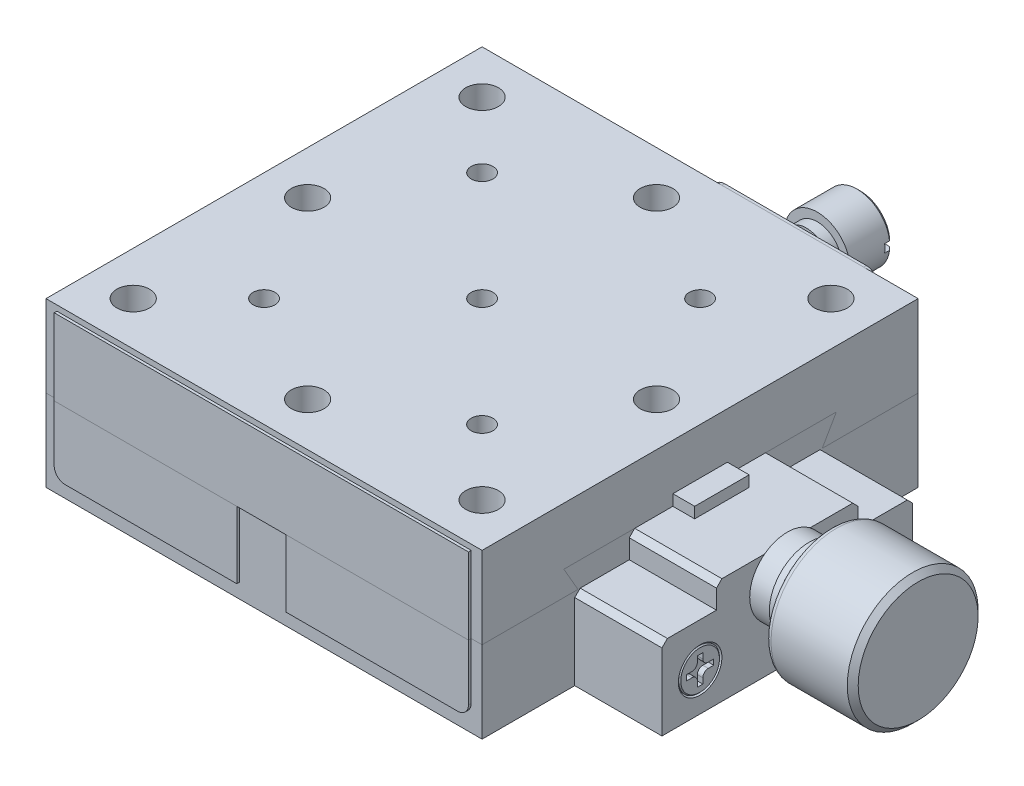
SolidWorks part; units mm, degrees
ref_plane "Front Plane" through (0, 0, 0) normal (0, 0, 1) x (1, 0, 0)
ref_plane "Top Plane" through (0, 0, 0) normal (0, 1, 0) x (1, 0, 0)
ref_plane "Right Plane" through (0, 0, 0) normal (1, 0, 0) x (0, 0, -1)
sketch "Sketch1" plane through (0, 0, 0) normal (0, 0, 1) x (1, 0, 0)
  line L0 (-17.5553, 0) -> (22.6305, 0) construction
  line L1 (-20, 7.5) -> (20, 7.5)
  line L2 (-20, 7.5) -> (-20, -7.5)
  line L3 (-20, -7.5) -> (20, -7.5)
  line L4 (20, 7.5) -> (20, -7.5)
  line L5 (0, 11.3249) -> (0, -12.2184) construction
  dimension "D1" = 40
  dimension "D2" = 15
extrude "Extrude1" add sketch "Sketch1" against normal mid plane 40
sketch "Sketch3" plane through (-20, 0, 0) normal (-1, 0, 0) x (0, 0, 1)
  line L0 (-20, 0) -> (-11.201, 0)
  line L2 (-11.201, 0) -> (-12.5, 2.25)
  line L3 (-12.5, 2.25) -> (12.5, 2.25)
  line L4 (12.5, 2.25) -> (11.201, 0)
  line L5 (11.201, 0) -> (20, 0)
  line L7 (0, 9.2862) -> (0, -8.8555) construction
  line L9 (-20, -7.5) -> (20, -7.5) construction
  line L10 (-20, 7.5) -> (-20, -7.5) construction
  line L11 (20, 7.5) -> (20, -7.5) construction
  dimension "D1" = 25
  dimension "D2" = 2.25
  dimension "D3" = 60
  dimension "D4" = 7.5
split "Split1" trim tools "Sketch3" resulting bodies 102 103
sketch "Sketch4" plane through (20, 0, 0) normal (1, 0, 0) x (0, 0, -1)
  line L0 (-11.5, -7.5) -> (-11.5, 0)
  line L1 (-20, 0) -> (-11.201, 0) construction
  line L2 (-11.5, 0) -> (-6.5, 0)
  line L3 (-6.5, 0) -> (-6.5, 2.25)
  line L4 (-6.5, 2.25) -> (6.5, 2.25)
  line L5 (6.5, 2.25) -> (6.5, 0)
  line L6 (6.5, 0) -> (11.5, 0)
  line L7 (11.201, 0) -> (20, 0) construction
  line L8 (11.5, 0) -> (11.5, -7.5)
  line L9 (11.5, -7.5) -> (-11.5, -7.5)
  line L10 (0, 10.5069) -> (0, -9.7219) construction
  line L12 (-12.5, 2.25) -> (12.5, 2.25) construction
  line L13 (20, -7.5) -> (-20, -7.5) construction
  dimension "D1" = 13
  dimension "D2" = 23
extrude "Extrude2" add sketch "Sketch4" along normal blind 8 separate body
sketch "Sketch5" plane through (0, 0, 0) normal (0, 0, 1) x (1, 0, 0)
  line L0 (-16.9557, -0.5) -> (34.9975, -0.5) construction
  line L1 (28, -0.5) -> (28, 2.95)
  line L2 (28, 2.95) -> (30, 2.95)
  line L3 (30, 2.95) -> (30, 3.15)
  line L4 (32, 3.15) -> (32, 5)
  line L5 (32.5, 5.5) -> (39.5, 5.5)
  line L6 (40, 5) -> (40, -0.5)
  line L7 (28, 0) -> (28, -7.5) construction
  line L8 (20, -7.5) -> (20, 0) construction
  line L10 (-20, -7.5) -> (20, -7.5) construction
  line L11 (39.5, 5.5) -> (40, 5)
  line L12 (28, 2.25) -> (20, 2.25) construction
  line L13 (30, 3.15) -> (32, 3.15)
  line L14 (28, -0.5) -> (40, -0.5)
  arc A0 (32, 5) -> (32.5, 5.5) centre (32.5, 5) cw
  point P17 (40, 5.5)
  dimension "D4" = 0.5
  dimension "D1" = 20
  dimension "D2" = 12
  dimension "D3" = 7
  dimension "D6" = 0.5
  dimension "D5" = 2
  dimension "D7" = 0.7
  dimension "D8" = 0.2
revolve "Revolve1" add sketch "Sketch5" angle 360 about L0
ref_plane "Plane1" through (0, 0, 16) normal (0, 0, 1) x (1, 0, 0)
sketch "Sketch7" plane through (0, 0, 16) normal (0, 0, 1) x (1, 0, 0)
  line L0 (0, 10.5598) -> (0, -0.7863) construction
  line L1 (20, 7.5) -> (-20, 7.5) construction
  line L2 (0, 7.5) -> (1.5, 7.5)
  line L3 (0, 7.5) -> (0, 0.5987)
  line L4 (-0.3822, 1.5) -> (1.4322, 1.5) construction
  line L5 (1.5, 7.5) -> (1.5, 1.5)
  line L6 (1.5, 1.5) -> (0, 0.5987)
  dimension "D1" = 59
  dimension "D2" = 6
  dimension "D3" = 3
revolve "Cut-Revolve1" cut sketch "Sketch7" angle 360 about L0
pattern_linear "LPattern1" count 2 spacing 16 along (1, 0, 0) count 2 spacing 16 along (-1, 0, 0) of "Cut-Revolve1"
pattern_linear "LPattern2" count 2 spacing 32 along (0, 0, -1) of "LPattern1", "Cut-Revolve1"
sketch "Sketch8" plane through (0, 0, 0) normal (0, 0, 1) x (1, 0, 0)
  line L0 (-16, 8.7759) -> (-16, -1.8346) construction
  line L1 (20, 7.5) -> (-20, 7.5) construction
  line L2 (-16, 7.5) -> (-14.5, 7.5)
  line L3 (-16, 7.5) -> (-16, 1.3487)
  line L4 (-16, 1.3487) -> (-14.5, 2.25)
  line L5 (-14.5, 7.5) -> (-14.5, 2.25)
  line L6 (20, 2.25) -> (-20, 2.25) construction
  dimension "D2" = 3
  dimension "D3" = 16
  dimension "D4" = 59
revolve "Cut-Revolve2" cut sketch "Sketch8" angle 360 about L0
pattern_linear "LPattern3" count 2 spacing 32 along (1, 0, 0) of "Cut-Revolve2"
sketch "Sketch9" plane through (0, 2.25, 0) normal (0, 1, 0) x (-1, 0, 0)
  line L0 (-20, -20) -> (-20, 20) construction
  line L1 (-22, -2.5) -> (-20, -2.5)
  line L2 (-22, -2.5) -> (-22, 2.5)
  line L3 (-22, 2.5) -> (-20, 2.5)
  line L4 (-20, -2.5) -> (-20, 2.5)
  line L5 (-17.8737, 0) -> (-1.2554, 0) construction
  dimension "D1" = 5
  dimension "D2" = 2
extrude "Extrude3" add sketch "Sketch9" along normal blind 1 separate body
ref_plane "Plane2" through (8, 0, 0) normal (1, 0, 0) x (0, 0, -1)
sketch "Sketch10" plane through (8, 0, 0) normal (1, 0, 0) x (0, 0, -1)
  line L0 (-16.0871, 4) -> (16.1877, 4) construction
  line L1 (20, -7.5) -> (-20, -7.5) construction
  line L2 (20.25, 5.98) -> (21.75, 5.98)
  line L3 (20, -7.5) -> (20, 0) construction
  line L4 (21.75, 5.98) -> (21.75, 6.23)
  line L5 (21.75, 6.23) -> (22.75, 6.23)
  line L6 (22.75, 6.23) -> (22.75, 7)
  line L7 (22.75, 7) -> (26.4, 7)
  line L8 (26.7, 6.7) -> (26.7, 4)
  line L9 (26.7, 4) -> (20, 4)
  line L10 (20.25, 4.98) -> (20.25, 5.98)
  line L11 (26.4, 7) -> (26.7, 6.7)
  line L12 (20, 0) -> (20, 7.5) construction
  line L13 (20.25, 4.98) -> (20, 4.98)
  line L14 (20, 4.98) -> (20, 4)
  point P16 (26.7, 7)
  dimension "D1" = 11.5
  dimension "D2" = 6
  dimension "D3" = 6.7
  dimension "D4" = 0.25
  dimension "D5" = 1
  dimension "D6" = 0.98
  dimension "D7" = 0.25
  dimension "D8" = 1
  dimension "D10" = 0.3
  dimension "D9" = 1.5
revolve "Revolve2" add sketch "Sketch10" angle 360 about L0
sketch "Sketch11" plane through (8, 0, 0) normal (1, 0, 0) x (0, 0, -1)
  line L0 (26.7, 1.3) -> (26.7, 6.7) construction
  line L1 (25.95, 4.375) -> (26.7, 4.375)
  line L2 (25.95, 4.375) -> (25.95, 3.625)
  line L3 (25.95, 3.625) -> (26.7, 3.625)
  line L4 (26.7, 4.375) -> (26.7, 3.625)
  line L5 (10.1527, 4) -> (21.4889, 4) construction
  line L6 (-16.0871, 4) -> (16.1877, 4) construction
  dimension "D1" = 0.75
  dimension "D2" = 0.75
extrude "Cut-Extrude2" cut sketch "Sketch11" against normal mid plane 11.5
sketch "Sketch12" plane through (0, 0, 16) normal (0, 0, 1) x (1, 0, 0)
  line L0 (-16, 0.5868) -> (-16, -12.2814) construction
  line L1 (-16, 0) -> (-13, 0)
  line L2 (-20, 0) -> (20, 0) construction
  line L3 (-13, 0) -> (-13, -4)
  line L4 (-13, -4) -> (-14.25, -4)
  line L5 (-14.25, -4) -> (-14.25, -7.5)
  line L6 (-20, -7.5) -> (20, -7.5) construction
  line L7 (-14.25, -7.5) -> (-16, -7.5)
  line L8 (-16, -7.5) -> (-16, 0)
  dimension "D1" = 16
  dimension "D2" = 3.5
  dimension "D3" = 6
  dimension "D4" = 3.5
revolve "Cut-Revolve3" cut sketch "Sketch12" angle 360 about L0
pattern_linear "LPattern4" count 2 spacing 32 along (0, 0, -1) count 2 spacing 32 along (1, 0, 0) of "Cut-Revolve3"
sketch "Sketch13" plane through (0, 0, 20) normal (0, 0, 1) x (1, 0, 0)
  line L0 (-19, -5.15) -> (-19, 0)
  line L2 (19, 0) -> (19, -5.15)
  line L4 (-19, 0) -> (19, 0)
  line L6 (-20, 0) -> (20, 0) construction
  line L8 (18, -6.15) -> (-18, -6.15)
  line L11 (0, 14.0975) -> (0, -10.6657) construction
  arc A0 (-19, -5.15) -> (-18, -6.15) centre (-18, -5.15) ccw
  arc A1 (18, -6.15) -> (19, -5.15) centre (18, -5.15) ccw
  point P24 (-19, -6.15)
  dimension "D3" = 1
  dimension "D1" = 6.15
  dimension "D2" = 38
extrude "Extrude4" add sketch "Sketch13" along normal blind 0.25 separate body
sketch "Sketch14" plane through (0, 0, -20) normal (0, 0, -1) x (-1, 0, 0)
  line L0 (20, -7.5) -> (-20, -7.5) construction
  line L2 (-1, -6.5) -> (-1, 6.5)
  line L3 (-20, 7.5) -> (20, 7.5) construction
  line L4 (-2, 7.5) -> (-15, 7.5)
  line L5 (-16, 6.5) -> (-16, -6.5)
  line L6 (-20, 0) -> (-20, 7.5) construction
  line L7 (-14, 5) -> (-3, 5)
  line L8 (-14.5, 4.5) -> (-14.5, 3.5)
  line L9 (-14, 3) -> (-3, 3)
  line L10 (-2.5, 4.5) -> (-2.5, 3.5)
  line L11 (-8.5, 14.1335) -> (-8.5, -6.1072) construction
  line L12 (-14.0826, 4) -> (7.454, 4) construction
  line L13 (-15, -7.5) -> (-2, -7.5)
  arc A0 (-16, -6.5) -> (-15, -7.5) centre (-15, -6.5) ccw
  arc A1 (-15, 7.5) -> (-16, 6.5) centre (-15, 6.5) ccw
  arc A2 (-1, 6.5) -> (-2, 7.5) centre (-2, 6.5) ccw
  arc A3 (-1, -6.5) -> (-2, -7.5) centre (-2, -6.5) cw
  arc A5 (-14, 5) -> (-14.5, 4.5) centre (-14, 4.5) ccw
  arc A6 (-14.5, 3.5) -> (-14, 3) centre (-14, 3.5) ccw
  arc A7 (-3, 3) -> (-2.5, 3.5) centre (-3, 3.5) ccw
  arc A8 (-3, 5) -> (-2.5, 4.5) centre (-3, 4.5) cw
  point P20 (-16, 7.5)
  point P23 (-1, 7.5)
  point P32 (-14.5, 5)
  point P39 (-2.5, 5)
  point P40 (-16, -7.5)
  point P43 (-1, -7.5)
  dimension "D5" = 1
  dimension "D6" = 0.5
  dimension "D9" = 1
  dimension "D1" = 4
  dimension "D2" = 15
  dimension "D4" = 12
  dimension "D7" = 2
  dimension "D8" = 11.5
extrude "Extrude6" add sketch "Sketch14" along normal blind 0.25 separate body
sketch "Sketch26" plane through (0, 0, 20) normal (0, 0, 1) x (1, 0, 0)
  line L0 (19, -5.15) -> (19, 0) construction
  line L1 (-19, 0) -> (19, 0)
  line L2 (-19, 0) -> (-19, 7)
  line L3 (-19, 7) -> (19, 7)
  line L4 (19, 0) -> (19, 7)
  dimension "D1" = 7
extrude "Extrude9" add sketch "Sketch26" along normal blind 0.25 separate body
sketch "Sketch15" plane through (28, 0, 0) normal (1, 0, 0) x (0, 0, -1)
  line L0 (0, 12.9894) -> (0, -12.6202) construction
  circle A0 centre (-8, -4) radius 2
  circle A1 centre (8, -4) radius 2
  dimension "D1" = 4
  dimension "D2" = 16
  dimension "D3" = 4
extrude "Cut-Extrude3" cut sketch "Sketch15" against normal blind 2
sketch "Sketch16" plane through (26, 0, 0) normal (1, 0, 0) x (0, 0, -1)
  circle A0 centre (-8, -4) radius 1.875
  circle A1 centre (-8, -4) radius 2 construction
  dimension "D1" = 3.75
extrude "Extrude7" add sketch "Sketch16" along normal blind 2 separate body
chamfer "Chamfer1" distance 0.1 angle 45 1 edges at (28, -2.125, 8)
sketch "Sketch17" plane through (28, 0, 0) normal (1, 0, 0) x (0, 0, -1)
  line L0 (-8, -2.6113) -> (-8, -5.3425) construction
  line L1 (-9.4433, -4) -> (-6.9033, -4) construction
  line L2 (-9.25, -4.25) -> (-9.25, -3.75)
  line L3 (-9.25, -3.75) -> (-8.25, -3.75)
  line L4 (-8.25, -3.75) -> (-8.25, -2.75)
  line L5 (-8.25, -2.75) -> (-7.75, -2.75)
  line L6 (-7.75, -2.75) -> (-7.75, -3.75)
  line L7 (-7.75, -3.75) -> (-6.75, -3.75)
  line L8 (-6.75, -3.75) -> (-6.75, -4.25)
  line L9 (-6.75, -4.25) -> (-7.75, -4.25)
  line L10 (-7.75, -4.25) -> (-7.75, -5.25)
  line L11 (-7.75, -5.25) -> (-8.25, -5.25)
  line L12 (-8.25, -5.25) -> (-8.25, -4.25)
  line L13 (-8.25, -4.25) -> (-9.25, -4.25)
  dimension "D1" = 0.5
  dimension "D2" = 8
  dimension "D3" = 2.5
  dimension "D4" = 2.5
  dimension "D5" = 0.5
  dimension "D6" = 4
extrude "Cut-Extrude4" cut sketch "Sketch17" against normal blind 0.5
fillet "Fillet2" radius 0.5 4 edges at (27.75, -4.25, 7.75) (27.75, -4.25, 8.25) (27.75, -3.75, 8.25) (27.75, -3.75, 7.75)
pattern_linear "LPattern5" count 2 spacing 16 along (0, 0, -1)
sketch "Sketch18" plane through (0, 0, -20.25) normal (0, 0, -1) x (-1, 0, 0)
  line L0 (-8, 10.7386) -> (-8, -9.8413) construction
  line L1 (-15, -7.5) -> (-2, -7.5) construction
  circle A0 centre (-11.25, -5) radius 1
  circle A1 centre (-4.75, -5) radius 1
  dimension "D2" = 2
  dimension "D1" = 8
  dimension "D3" = 2.5
  dimension "D4" = 6.5
extrude "Extrude8" add sketch "Sketch18" along normal blind 0.8 separate body
fillet "Fillet1" radius 0.25 1 edges at (10.25, -5, -21.05)
fillet "Fillet3" radius 0.25 1 edges at (3.75, -5, -21.05)
sketch "Sketch19" plane through (0, 0, -21.05) normal (0, 0, -1) x (-1, 0, 0)
  line L0 (-8.4281, -5) -> (-5.6071, -5) construction
  line L1 (-11.35, -4.25) -> (-11.15, -4.25)
  line L2 (-11.15, -4.25) -> (-11.15, -4.9)
  line L3 (-11.15, -4.9) -> (-10.5, -4.9)
  line L4 (-10.5, -4.9) -> (-10.5, -5.1)
  line L5 (-10.5, -5.1) -> (-11.15, -5.1)
  line L6 (-11.15, -5.1) -> (-11.15, -5.75)
  line L7 (-11.15, -5.75) -> (-11.35, -5.75)
  line L8 (-11.35, -5.75) -> (-11.35, -5.1)
  line L9 (-11.35, -5.1) -> (-12, -5.1)
  line L10 (-12, -5.1) -> (-12, -4.9)
  line L11 (-12, -4.9) -> (-11.35, -4.9)
  line L12 (-11.35, -4.9) -> (-11.35, -4.25)
  line L13 (-11.25, 2.5) -> (-11.25, 0.5) construction
  line L14 (-4.85, -5.1) -> (-4.85, -5.75)
  line L15 (-15, -7.5) -> (-2, -7.5) construction
  line L16 (-4.65, -5.1) -> (-4.65, -5.75)
  line L17 (-4.75, -2.5823) -> (-4.75, -6.9988) construction
  line L20 (-5.5, -4.9) -> (-4.85, -4.9)
  line L21 (-5.5, -4.9) -> (-5.5, -5.1)
  line L22 (-5.5, -5.1) -> (-4.85, -5.1)
  line L24 (-4, -4.9) -> (-4.65, -4.9)
  line L25 (-4, -4.9) -> (-4, -5.1)
  line L26 (-4, -5.1) -> (-4.65, -5.1)
  line L28 (-4.85, -4.25) -> (-4.65, -4.25)
  line L29 (-4.85, -4.25) -> (-4.85, -4.9)
  line L30 (-4.85, -5.75) -> (-4.65, -5.75)
  line L31 (-4.65, -4.25) -> (-4.65, -4.9)
  dimension "D1" = 1.5
  dimension "D2" = 0.2
  dimension "D3" = 11.25
  dimension "D4" = 2.5
  dimension "D5" = 1.5
  dimension "D6" = 6.5
extrude "Cut-Extrude5" cut sketch "Sketch19" against normal blind 0.25
sketch "Sketch22" plane through (0, 0, 20.25) normal (0, 0, 1) x (1, 0, 0)
  line L0 (19, 0) -> (-19, 0) construction
  line L1 (-2.25, 0) -> (2.25, 0)
  line L2 (-2.25, 0) -> (-2.25, -6.5)
  line L3 (-2.25, -6.5) -> (2.25, -6.5)
  line L4 (2.25, 0) -> (2.25, -6.5)
  line L6 (0, 0) -> (0, 12.5984) construction
  dimension "D1" = 4.5
  dimension "D2" = 6.5
ref_plane "Plane3" through (0, 0, -10) normal (0, 0, 1) x (1, 0, 0)
sketch "Sketch24" plane through (0, 0, -10) normal (0, 0, 1) x (1, 0, 0)
  line L0 (-10, 11.9255) -> (-10, -1.458) construction
  line L1 (-10, 7.5) -> (-9, 7.5)
  line L2 (20, 7.5) -> (-20, 7.5) construction
  line L3 (-9, 7.5) -> (-9, 1.5)
  line L4 (-10, 0.8991) -> (-9, 1.5)
  line L5 (-10, 0.8991) -> (-10, 7.5)
  dimension "D1" = 10
  dimension "D2" = 2
  dimension "D3" = 6
  dimension "D4" = 59
revolve "Cut-Revolve4" cut sketch "Sketch24" angle 360 about L0
pattern_linear "LPattern7" count 3 spacing 10 along (0, 0, 1) count 3 spacing 10 along (1, 0, 0) of "Cut-Revolve4"
chamfer "Chamfer2" distance 0.5 angle 45 4 edges at (24, 2.25, 6.5) (24, 2.25, -6.5) (24, 0, -11.5) (24, 0, 11.5)
extrude "Cut-Extrude7" cut sketch "Sketch22" against normal up to next
sketch "草圖2" plane through (-20, 0, 0) normal (-1, 0, 0) x (0, 0, 1)
  line L4 (-11.9261, -3.8496) -> (-11.9261, -4.7413)
  line L5 (-11.9261, -3.8496) -> (-11.6276, -3.8496)
  line L6 (-11.534, -3.756) -> (-11.534, -3.5472)
  line L7 (-11.534, -3.5472) -> (-12.6151, -3.5472)
  line L8 (-12.6151, -3.5472) -> (-12.6151, -3.844)
  line L9 (-12.6151, -3.844) -> (-12.2281, -3.844)
  line L10 (-12.2281, -3.844) -> (-12.2281, -4.646)
  line L11 (-12.1352, -4.7396) -> (-11.9261, -4.7413)
  line L12 (-12.6962, -3.5472) -> (-13.035, -3.5472)
  line L13 (-13.735, -3.5472) -> (-14.0733, -3.5472)
  line L14 (-14.1511, -3.5472) -> (-14.782, -3.5472)
  line L15 (-14.0733, -3.5472) -> (-14.0733, -4.7389)
  line L16 (-12.6966, -4.7389) -> (-12.8978, -4.7389)
  line L17 (-13.2974, -4.7389) -> (-13.4725, -4.7389)
  line L18 (-13.8721, -4.7389) -> (-14.0733, -4.7389)
  line L19 (-14.1576, -4.7389) -> (-14.782, -4.7389)
  line L20 (-13.735, -3.5472) -> (-13.385, -4.3587)
  line L21 (-13.7785, -4.046) -> (-13.7785, -4.6453)
  line L22 (-13.7785, -4.046) -> (-13.4725, -4.7389)
  line L23 (-12.6966, -3.5472) -> (-12.6966, -4.7389)
  line L24 (-12.9914, -4.046) -> (-12.9914, -4.6453)
  line L25 (-12.9914, -4.046) -> (-13.2974, -4.7389)
  line L26 (-13.035, -3.5472) -> (-13.385, -4.3587)
  line L27 (-14.1576, -4.0051) -> (-14.7597, -4.0051)
  line L28 (-14.1576, -4.0051) -> (-14.1576, -4.7389)
  line L29 (-14.7597, -4.0051) -> (-14.7597, -4.1657)
  line L30 (-14.4169, -4.2593) -> (-14.6661, -4.2593)
  line L31 (-14.4169, -4.2593) -> (-14.4169, -4.4872)
  line L32 (-14.4169, -4.4872) -> (-14.782, -4.4872)
  line L33 (-14.1511, -3.5472) -> (-14.1511, -3.6962)
  line L34 (-14.782, -3.7898) -> (-14.2447, -3.7898)
  line L35 (-16.2454, -5.0717) -> (-15.8705, -4.1192)
  line L36 (-15.8705, -4.1192) -> (-16.2082, -4.1195)
  line L37 (-16.2082, -4.1195) -> (-16.5248, -4.5264)
  line L38 (-15.3784, -3.3671) -> (-15.3784, -3.4536)
  line L39 (-16.2454, -5.0717) -> (-17.1325, -5.0766)
  arc A0 (-11.6276, -3.8496) -> (-11.534, -3.756) centre (-11.6276, -3.756) ccw
  arc A1 (-12.2281, -4.646) -> (-12.1352, -4.7396) centre (-12.1344, -4.646) ccw
  arc A2 (-13.8721, -4.7389) -> (-13.7785, -4.6453) centre (-13.8721, -4.6453) ccw
  arc A3 (-12.9914, -4.6453) -> (-12.8978, -4.7389) centre (-12.8978, -4.6453) ccw
  arc A4 (-14.7597, -4.1657) -> (-14.6661, -4.2593) centre (-14.6661, -4.1657) ccw
  arc A5 (-14.2447, -3.7898) -> (-14.1511, -3.6962) centre (-14.2447, -3.6962) ccw
  arc A6 (-14.782, -3.7898) -> (-14.782, -4.4872) centre (-14.5645, -4.1385) ccw
  arc A7 (-14.782, -3.5472) -> (-14.782, -4.7389) centre (-14.6803, -4.1431) ccw
  arc A8 (-16.9649, -4.51) -> (-16.5248, -4.5264) centre (-16.5715, 0.1275) ccw
  arc A9 (-17.3251, -4.462) -> (-16.9649, -4.51) centre (-16.9476, -3.0048) ccw
  arc A10 (-17.6052, -4.3473) -> (-17.3251, -4.462) centre (-17.1902, -3.7331) ccw
  arc A11 (-17.6757, -4.2249) -> (-17.6052, -4.3473) centre (-17.5351, -4.2254) ccw
  arc A12 (-17.6313, -4.1237) -> (-17.6757, -4.2249) centre (-17.4835, -4.249) ccw
  arc A13 (-17.4805, -3.9899) -> (-17.6313, -4.1237) centre (-17.143, -4.5221) ccw
  arc A14 (-17.2769, -3.879) -> (-17.4805, -3.9899) centre (-16.6144, -5.338) ccw
  arc A15 (-17.2769, -3.879) -> (-17.0242, -3.7794) centre (-19.1963, 1.3593) ccw
  arc A16 (-17.0242, -3.7794) -> (-16.7977, -3.7118) centre (-22.3664, 14.5374) ccw
  arc A17 (-16.573, -3.6528) -> (-16.7977, -3.7118) centre (-16.3683, -4.8904) ccw
  arc A18 (-16.573, -3.6528) -> (-16.3848, -3.6135) centre (-16.7935, -2.127) ccw
  arc A19 (-16.1442, -3.567) -> (-16.3848, -3.6135) centre (-14.8771, -10.7725) ccw
  arc A20 (-16.1442, -3.567) -> (-15.9167, -3.5263) centre (-16.3607, -1.7008) ccw
  arc A21 (-15.9167, -3.5263) -> (-15.7145, -3.4955) centre (-15.9942, -2.3414) ccw
  arc A22 (-15.5292, -3.4699) -> (-15.7145, -3.4955) centre (-13.5476, -18.5113) ccw
  arc A23 (-15.3784, -3.4536) -> (-15.5292, -3.4699) centre (-15.3383, -4.5329) ccw
  arc A24 (-17.1325, -5.0766) -> (-17.43, -5.0504) centre (-19.772, -33.373) ccw
  arc A25 (-17.7618, -5.008) -> (-17.43, -5.0504) centre (-16.9899, -0.2828) ccw
  arc A26 (-18.1985, -4.8953) -> (-17.7618, -5.008) centre (-17.2792, -2.2362) ccw
  arc A27 (-18.4933, -4.7059) -> (-18.1985, -4.8953) centre (-17.8579, -4.0413) ccw
  arc A28 (-18.5691, -4.527) -> (-18.4933, -4.7059) centre (-18.3314, -4.5318) ccw
  arc A29 (-18.4722, -4.2934) -> (-18.5691, -4.527) centre (-18.1609, -4.5593) ccw
  arc A30 (-18.2448, -4.0703) -> (-18.4722, -4.2934) centre (-17.5189, -5.0376) ccw
  arc A31 (-17.9711, -3.9145) -> (-18.2448, -4.0703) centre (-16.4338, -6.9347) ccw
  arc A32 (-17.7099, -3.7961) -> (-17.9711, -3.9145) centre (-16.591, -6.6121) ccw
  arc A33 (-17.5258, -3.731) -> (-17.7099, -3.7961) centre (-4.0503, -42.1208) ccw
  arc A34 (-17.2589, -3.6538) -> (-17.5258, -3.731) centre (-16.7013, -6.0798) ccw
  arc A35 (-16.9814, -3.5835) -> (-17.2589, -3.6538) centre (-16.18, -7.3307) ccw
  arc A36 (-16.7213, -3.5332) -> (-16.9814, -3.5835) centre (-15.3439, -11.3592) ccw
  arc A37 (-16.7213, -3.5332) -> (-16.4959, -3.4905) centre (-17.0342, -1.2673) ccw
  arc A38 (-16.2939, -3.462) -> (-16.4959, -3.4905) centre (-16.2345, -4.6143) ccw
  arc A39 (-16.0584, -3.4342) -> (-16.2939, -3.462) centre (-15.9652, -5.2369) ccw
  arc A40 (-15.8494, -3.4073) -> (-16.0584, -3.4342) centre (-15.6816, -5.5286) ccw
  arc A41 (-15.657, -3.3884) -> (-15.8494, -3.4073) centre (-15.2885, -8.1421) ccw
  arc A42 (-15.7663, -3.3982) -> (-15.5191, -3.375) centre (-17.1326, 12.5541) ccw
  arc A43 (-15.3784, -3.3671) -> (-15.5191, -3.375) centre (-15.3938, -4.339) ccw
extrude "除料-伸長2" cut sketch "草圖2" against normal blind 0.02
sketch "草圖1" plane through (-20, 0, 0) normal (-1, 0, 0) x (0, 0, 1)
  line L0 (-20.25, -6.5) -> (-20.25, 6.5) construction
  line L1 (-18.75, -2.5) -> (-15.75, -2.5)
  line L2 (-18.75, -2.5) -> (-18.75, -5.5)
  line L3 (-18.75, -5.5) -> (-15.75, -5.5)
  line L4 (-15.75, -2.5) -> (-15.75, -5.5)
  line L6 (-20, -7.5) -> (20, -7.5) construction
  dimension "D1" = 3
  dimension "D2" = 3
  dimension "D3" = 1.5
  dimension "D4" = 2
extrude "除料-伸長1" cut sketch "草圖1" against normal blind 0.01
sketch "草圖3" plane through (-20, 0, 0) normal (-1, 0, 0) x (0, 0, 1)
  line L0 (8.725, -6.5) -> (19, -6.5) construction
  line L3 (20, 0) -> (20, -7.5) construction
  line L4 (-20, -7.5) -> (20, -7.5) construction
  text T0 "Made in Taiwan</i>" font "Century Gothic" height 0.8
  dimension "D1" = 1
  dimension "D2" = 1
extrude "除料-伸長3" cut sketch "草圖3" against normal blind 0.02
sketch "草圖4" plane through (-20, 0, 0) normal (-1, 0, 0) x (0, 0, 1)
  line L0 (-6.5036, -4.5) -> (6.5036, -4.5) construction
  line L2 (-20, -7.5) -> (20, -7.5) construction
  line L3 (0, 8.7036) -> (0, 0) construction
  text T0 "<i>MC2A-40</i>" font "Century Gothic" height 1.4
  dimension "D1" = 3
extrude "除料-伸長4" cut sketch "草圖4" against normal blind 0.01
